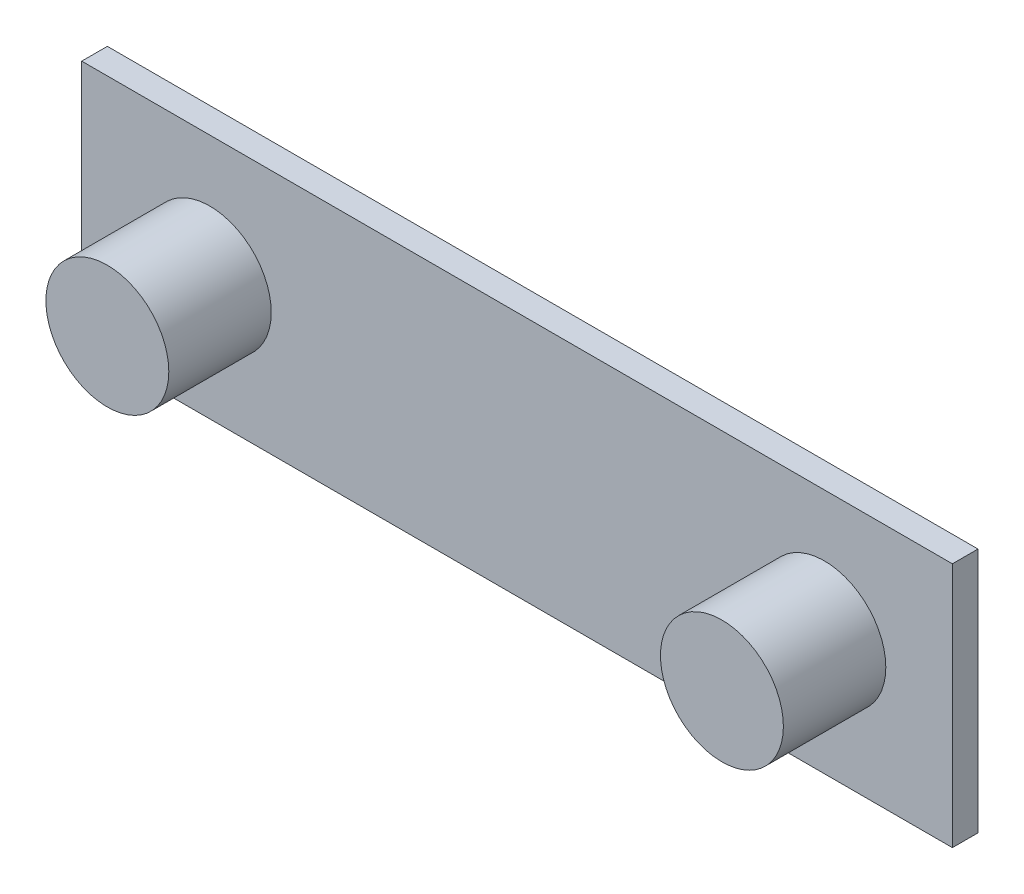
SolidWorks part; units mm, degrees
ref_plane "Front Plane" through (0, 0, 0) normal (0, 0, 1) x (1, 0, 0)
ref_plane "Top Plane" through (0, 0, 0) normal (0, 1, 0) x (1, 0, 0)
ref_plane "Right Plane" through (0, 0, 0) normal (1, 0, 0) x (0, 0, -1)
sketch "Sketch1" plane through (0, 0, 0) normal (0, 0, 1) x (1, 0, 0)
  line L0 (85, 24) -> (72.5, 24)
  line L1 (0, 0) -> (85, 0)
  line L2 (0, 0) -> (0, 24)
  line L3 (0, 24) -> (85, 24)
  line L4 (85, 0) -> (85, 24)
  dimension "D1" = 85
  dimension "D2" = 24
  dimension "D3" = 12.5
extrude "Boss-Extrude1" add sketch "Sketch1" along normal blind 2.5 contours L2 L1 L4 L3
sketch "Sketch2" plane through (0, 0, 2.5) normal (0, 0, 1) x (1, 0, 0)
  line L0 (0, 24) -> (12.5, 24)
  line L1 (0, 24) -> (85, 24) construction
  line L2 (85, 24) -> (72.5, 24)
  line L3 (12.5, 24) -> (12.5, 12)
  line L4 (72.5, 24) -> (72.5, 12)
  circle A0 centre (72.5, 12) radius 6
  circle A1 centre (12.5, 12) radius 6
  dimension "D4" = 12
  dimension "D1" = 12.5
  dimension "D2" = 12.5
  dimension "D3" = 12
extrude "Boss-Extrude2" add sketch "Sketch2" along normal blind 10 contours A1 | A0
